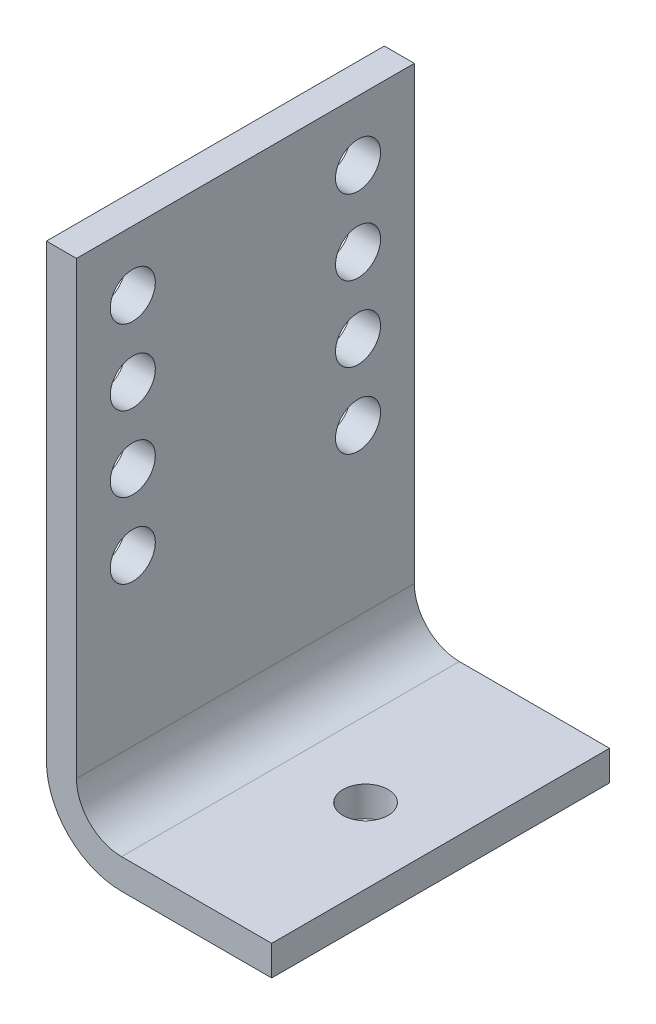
SolidWorks part; units mm, degrees
ref_plane "Front" through (0, 0, 0) normal (0, 0, 1) x (1, 0, 0)
ref_plane "Top" through (0, 0, 0) normal (0, 1, 0) x (1, 0, 0)
ref_plane "Right" through (0, 0, 0) normal (1, 0, 0) x (0, 0, -1)
sketch "Sketch1" plane through (0, 0, 0) normal (0, 0, 1) x (1, 0, 0)
  line L0 (0, 70) -> (0, 10)
  line L1 (10, 0) -> (30, 0)
  arc A0 (10, 0) -> (0, 10) centre (10, 10) cw
  point P6 (0, 0)
  dimension "D3" = 10
  dimension "D1" = 30
  dimension "D2" = 70
extrude "Base-Extrude-Thin" add sketch "Sketch1" along normal mid plane 45 thin
sketch "Sketch2" plane through (4, 0, 0) normal (1, 0, 0) x (0, 0, -1)
  line L0 (0, 70) -> (0, 0) construction
  line L3 (-22.5, 70) -> (22.5, 70) construction
  circle A0 centre (-15, 62) radius 3
  circle A1 centre (15, 62) radius 3
  dimension "D1" = 30
  dimension "D2" = 6
  dimension "D3" = 8
extrude "Cut-Extrude1" cut sketch "Sketch2" against normal through all
pattern_linear "LPattern3" count 4 spacing 10 along (0, -1, 0) of "Cut-Extrude1"
sketch "Sketch3" plane through (0, 4, 0) normal (0, 1, 0) x (-1, 0, 0)
  line L0 (-30, 0) -> (-20, 0) construction
  line L1 (-30, 22.5) -> (-30, -22.5) construction
  circle A0 centre (-20, 0) radius 3
  dimension "D1" = 6
  dimension "D2" = 10
extrude "Cut-Extrude2" cut sketch "Sketch3" against normal through all
